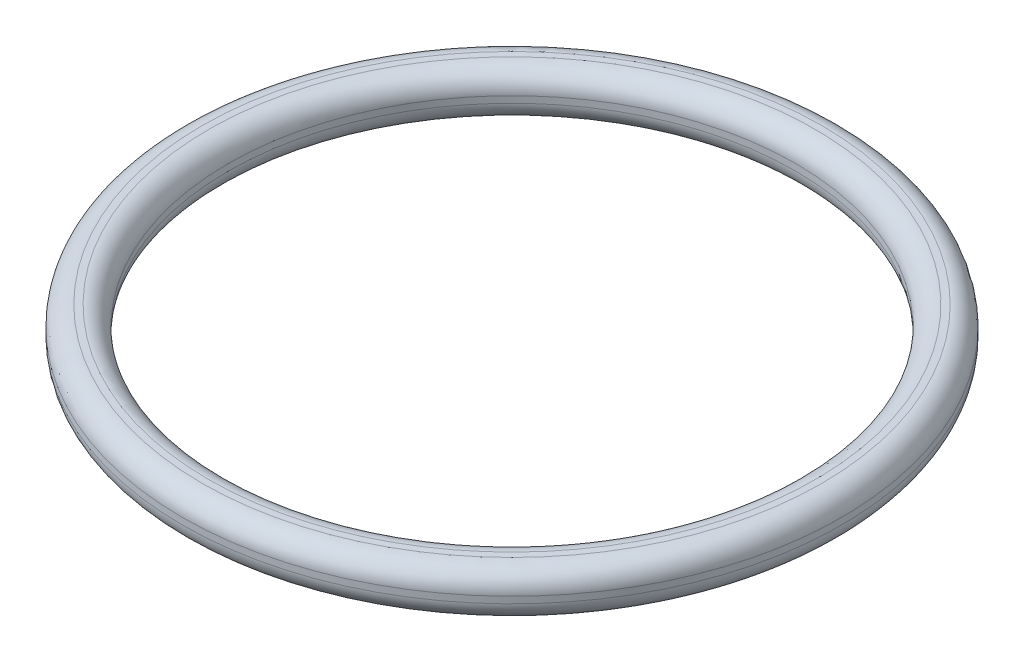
SolidWorks part; units mm, degrees
ref_plane "Front Plane" through (0, 0, 0) normal (0, 0, 1) x (1, 0, 0)
ref_plane "Top Plane" through (0, 0, 0) normal (0, 1, 0) x (1, 0, 0)
ref_plane "Right Plane" through (0, 0, 0) normal (1, 0, 0) x (0, 0, -1)
sketch "Sketch1" plane through (0, 0, 0) normal (0, 1, 0) x (1, 0, 0)
  circle A0 centre (0, 0) radius 10.9728
  circle A1 centre (0, 0) radius 12.7508
  dimension "D1" = 21.9456
  dimension "D2" = 25.5016
extrude "Boss-Extrude1" add sketch "Sketch1" along normal blind 1.778
fillet "Fillet1" radius 0.762 4 edges at (0, 0, 12.7508) (0, 1.778, 12.7508) (0, 1.778, 10.9728) (0, 0, 10.9728)
